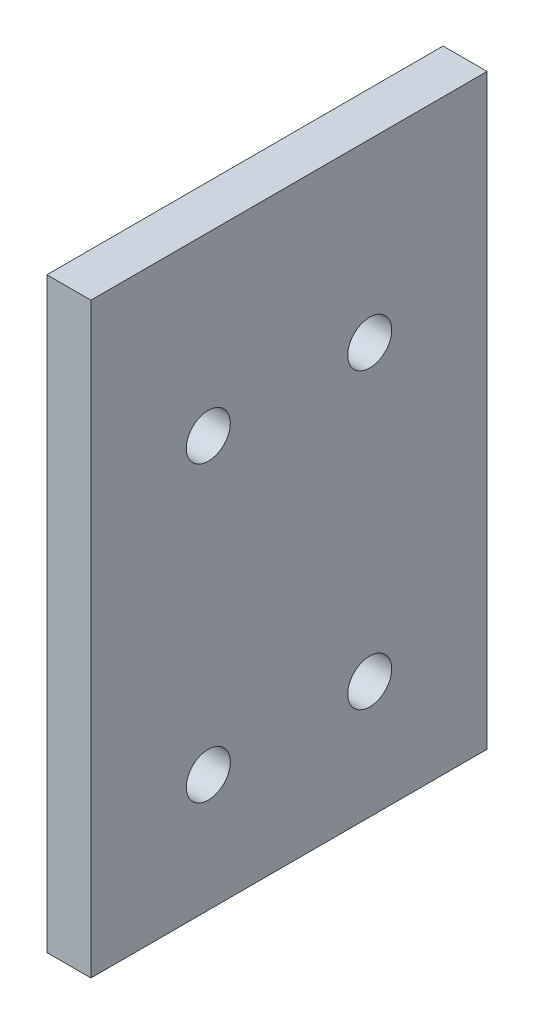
SolidWorks part; units mm, degrees
ref_plane "Front Plane" through (0, 0, 0) normal (0, 0, 1) x (1, 0, 0)
ref_plane "Top Plane" through (0, 0, 0) normal (0, 1, 0) x (1, 0, 0)
ref_plane "Right Plane" through (0, 0, 0) normal (1, 0, 0) x (0, 0, -1)
sketch "Sketch1" plane through (0, 0, 0) normal (1, 0, 0) x (0, 0, -1)
  line L1 (-13.5, 20) -> (13.5, 20)
  line L2 (-13.5, 20) -> (-13.5, -20)
  line L3 (-13.5, -20) -> (13.5, -20)
  line L4 (13.5, 20) -> (13.5, -20)
  circle A0 centre (-5.5, 8) radius 1.5
  circle A1 centre (5.5, 8) radius 1.5
  circle A2 centre (-5.5, -12) radius 1.5
  circle A3 centre (5.5, -12) radius 1.5
  point P0 (0, 0)
  point P14 (0, 0)
  dimension "D3" = 3
  dimension "D4" = 3
  dimension "D5" = 3
  dimension "D6" = 3
  dimension "D11" = 8
  dimension "D1" = 40
  dimension "D2" = 27
  dimension "D7" = 8
  dimension "D8" = 8
  dimension "D9" = 8
  dimension "D10" = 8
  dimension "D12" = 8
  dimension "D13" = 12
  dimension "D14" = 12
extrude "Boss-Extrude1" add sketch "Sketch1" along normal blind 3
